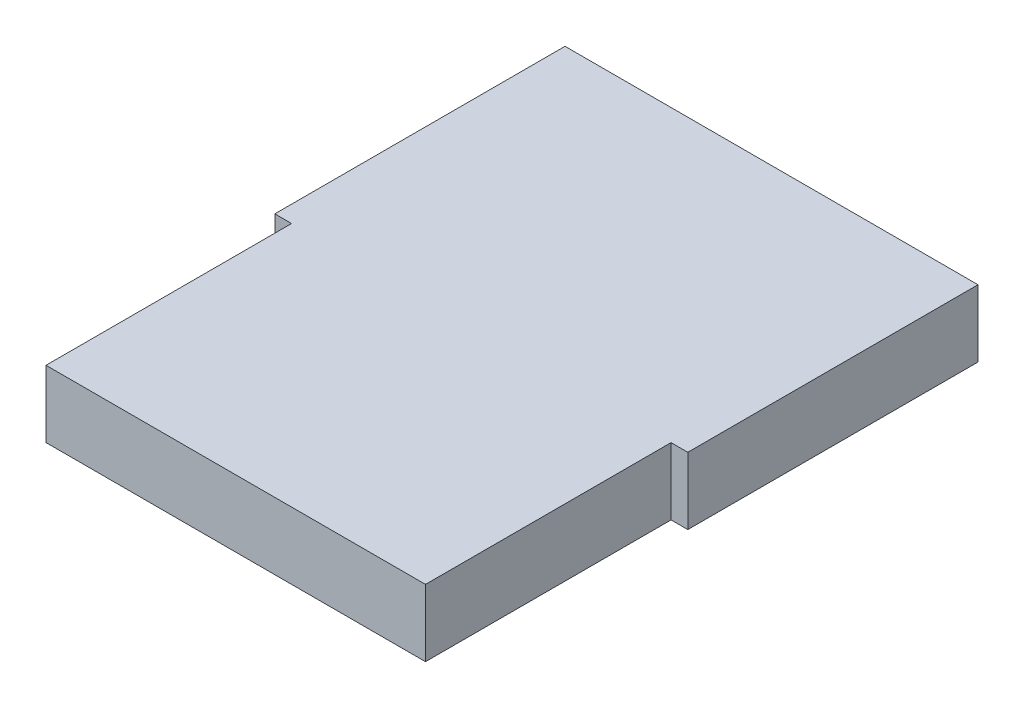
SolidWorks part; units mm, degrees
ref_plane "Front Plane" through (0, 0, 0) normal (0, 0, 1) x (1, 0, 0)
ref_plane "Top Plane" through (0, 0, 0) normal (0, 1, 0) x (1, 0, 0)
ref_plane "Right Plane" through (0, 0, 0) normal (1, 0, 0) x (0, 0, -1)
sketch "Sketch1" plane through (0, 0, 0) normal (0, 0, 1) x (1, 0, 0)
  line L0 (-27.6104, -18.5) -> (-27.6104, -22.5) construction
  line L1 (-27.6104, 18.5) -> (-27.6104, 12.7) construction
  line L3 (-46.1104, -22.5) -> (-9.1104, -22.5)
  line L5 (-55.2208, 32.3799) -> (0, -22.5) construction
  line L6 (-55.2208, -22.5) -> (0, 32.3799) construction
  line L7 (-9.1104, 0) -> (0, 0) construction
  line L8 (-46.1104, 0) -> (-55.2208, 0) construction
  line L9 (-27.6104, 18.5) -> (-27.6104, 32.3799) construction
  line L10 (-27.6104, -18.5) -> (-27.6104, 1) construction
  line L11 (-46.1104, 0) -> (-46.1104, -22.5)
  line L12 (-9.1104, 0) -> (-9.1104, -22.5)
  arc A0 (-9.1104, 0) -> (-46.1104, 0) centre (-27.6104, 0) ccw
  circle A1 centre (-27.6104, 6.85) radius 5.85
  point P2 (-27.6104, 4.94)
  dimension "D1" = 37
  dimension "D2" = 11.7
  dimension "D3" = 5.8
  dimension "D4" = 4
extrude "Boss-Extrude1" add sketch "Sketch1" along normal blind 4
sketch "Sketch2" plane through (0, 0, 0) normal (0, 0, 1) x (1, 0, 0)
  line L0 (-9.1104, -22.5) -> (-9.1104, 0) construction
  line L1 (-46.1104, -22.5) -> (-9.1104, -22.5)
  line L2 (-46.1104, -22.5) -> (-46.1104, -16.5)
  line L3 (-46.1104, -16.5) -> (-9.1104, -16.5)
  line L4 (-9.1104, -22.5) -> (-9.1104, -16.5)
  dimension "D1" = 6
extrude "Boss-Extrude2" add sketch "Sketch2" along normal blind 48
sketch "Sketch3" plane through (0, -16.5, 0) normal (0, 1, 0) x (1, 0, 0)
  line L0 (-44.6104, -26) -> (-44.6104, -48)
  line L1 (-46.1104, -48) -> (-46.1104, -4) construction
  line L2 (-46.1104, -26) -> (-46.1104, -48)
  line L3 (-9.1104, -48) -> (-46.1104, -48) construction
  line L4 (-44.6104, -48) -> (-46.1104, -48)
  line L6 (-10.6104, -26) -> (-10.6104, -48)
  line L7 (-9.1104, -48) -> (-9.1104, -4) construction
  line L8 (-9.1104, -26) -> (-9.1104, -48)
  line L9 (-44.6104, -26) -> (-46.1104, -26)
  line L10 (-10.6104, -48) -> (-9.1104, -48)
  line L11 (-46.1104, -26) -> (-46.1104, -48)
  line L14 (-10.6104, -26) -> (-9.1104, -26)
extrude "Cut-Extrude1" cut sketch "Sketch3" against normal blind 10 contours L14 L6 M5 M6 | L0 L9 M4 M5
sketch "Sketch4" plane through (0, 0, 4) normal (0, 0, 1) x (1, 0, 0)
  line L1 (-9.1104, -16.5) -> (-48.1113, -16.5)
  line L2 (-9.1104, -16.5) -> (-9.1104, 22.7563)
  line L3 (-9.1104, 22.7563) -> (-48.1113, 22.7563)
  line L4 (-48.1113, -16.5) -> (-48.1113, 22.7563)
extrude "Cut-Extrude2" cut sketch "Sketch4" against normal blind 10
